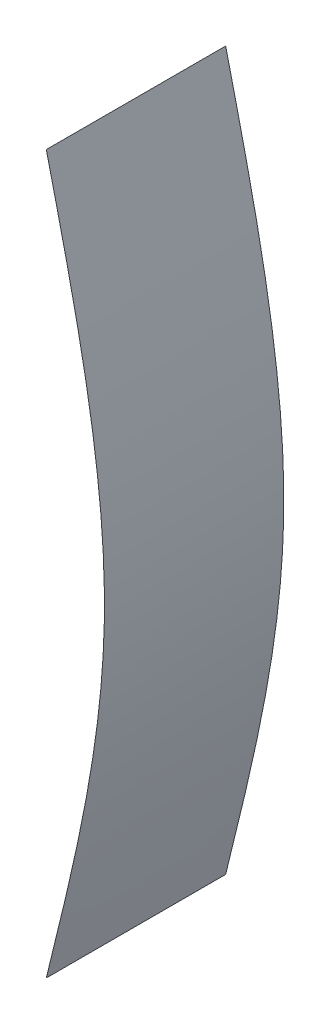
SolidWorks part; units mm, degrees
ref_plane "Plane1" through (0, 0, 0) normal (0, 0, 1) x (1, 0, 0)
ref_plane "Plane2" through (0, 0, 0) normal (0, 1, 0) x (1, 0, 0)
ref_plane "Plane3" through (0, 0, 0) normal (1, 0, 0) x (0, 0, -1)
sketch "Sketch1" plane through (0, 0, 0) normal (0, 0, 1) x (1, 0, 0)
  spline S0 degree 3 poles (0, 5) (3.9201, 20.8143) (12.1665, 54.0818) (4.1865, 87.4789) (0, 105) knots 0 0 0 0 0.47537 1 1 1 1
surface "Surface-Extrude1" sketch "Sketch1" parameters "D1"=25
